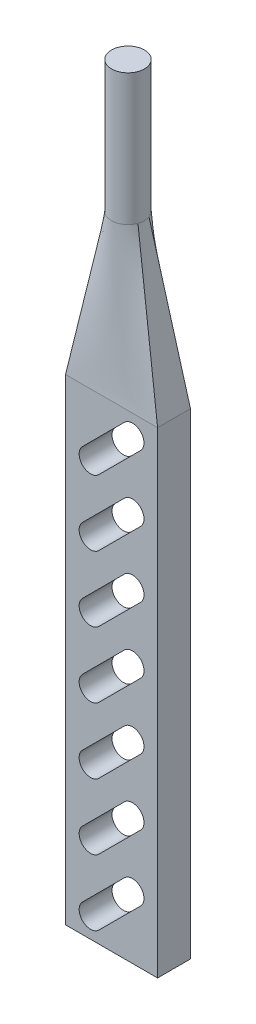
SolidWorks part; units mm, degrees
ref_plane "Front Plane" through (0, 0, 0) normal (0, 0, 1) x (1, 0, 0)
ref_plane "Top Plane" through (0, 0, 0) normal (0, 1, 0) x (1, 0, 0)
ref_plane "Right Plane" through (0, 0, 0) normal (1, 0, 0) x (0, 0, -1)
sketch "Sketch1" plane through (0, 0, 0) normal (0, 0, 1) x (1, 0, 0)
  line L1 (-14, -72.5) -> (14, -72.5)
  line L2 (-14, -72.5) -> (-14, 72.5)
  line L3 (-14, 72.5) -> (14, 72.5)
  line L4 (14, -72.5) -> (14, 72.5)
  line L5 (-14, -72.5) -> (14, 72.5) construction
  line L6 (-14, 72.5) -> (14, -72.5) construction
  point P0 (0, 0)
  dimension "D1" = 145
  dimension "D2" = 28
extrude "Boss-Extrude1" add sketch "Sketch1" along normal mid plane 10
sketch "Sketch2" plane through (0, 0, 0) normal (0, 0, 1) x (1, 0, 0)
  line L0 (-6.364, -6.364) -> (6.364, 6.364) construction
  line L1 (-8.8388, -3.8891) -> (3.8891, 8.8388)
  line L2 (-3.8891, -8.8388) -> (8.8388, 3.8891)
  line L3 (0, 0) -> (0, 14.9256) construction
  arc A0 (-8.8388, -3.8891) -> (-3.8891, -8.8388) centre (-6.364, -6.364) ccw
  arc A1 (8.8388, 3.8891) -> (3.8891, 8.8388) centre (6.364, 6.364) ccw
  point P2 (0, 0)
  dimension "D3" = 3.5
  dimension "D1" = 18
  dimension "D2" = 45
extrude "Cut-Extrude1" cut sketch "Sketch2" along normal through all and the other way through all
pattern_linear "LPattern1" count 4 spacing 20 along (0, 1, 0) count 4 spacing 20 along (0, -1, 0) of "Cut-Extrude1"
ref_plane "Plane1" through (0, 120, 0) normal (0, 1, 0) x (1, 0, 0)
sketch "Sketch3" plane through (0, 120, 0) normal (0, 1, 0) x (1, 0, 0)
  circle A0 centre (0, 0) radius 5
  dimension "D1" = 10
extrude "Boss-Extrude2" add sketch "Sketch3" along normal blind 40 separate body
loft "Loft1" add
